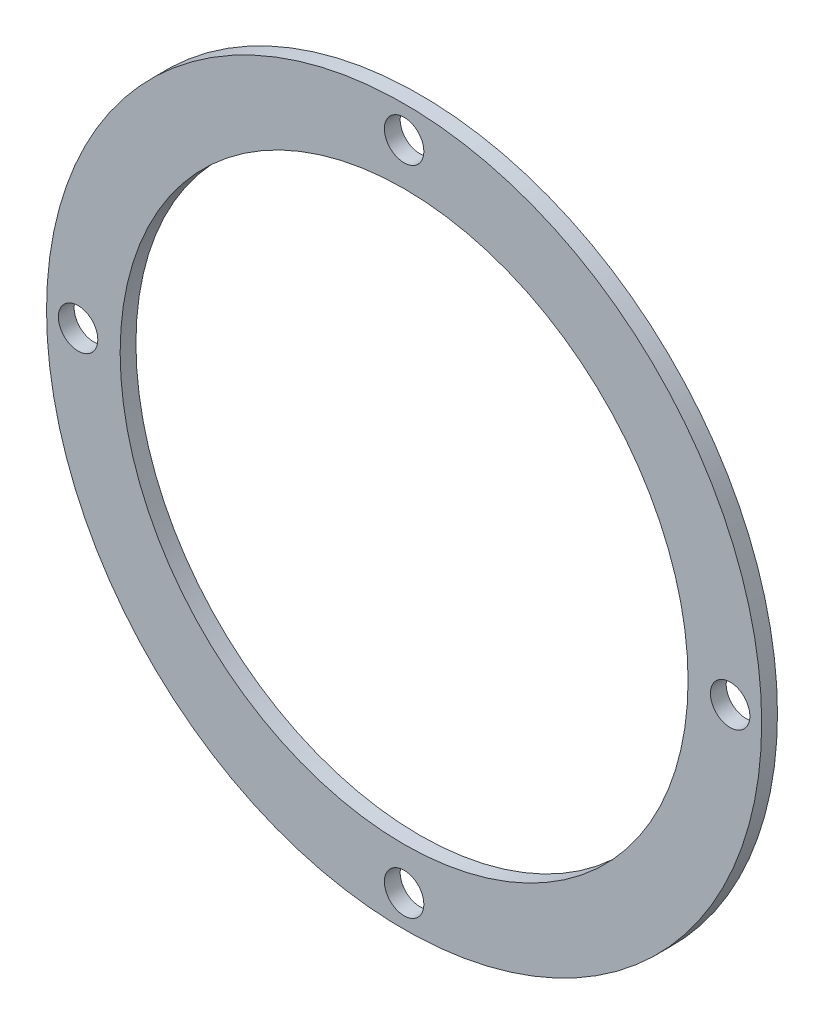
SolidWorks part; units mm, degrees
ref_plane "Plan1" through (0, 0, 0) normal (0, 0, 1) x (1, 0, 0)
ref_plane "Plan2" through (0, 0, 0) normal (0, 1, 0) x (1, 0, 0)
ref_plane "Plan3" through (0, 0, 0) normal (1, 0, 0) x (0, 0, -1)
sketch "Esquisse1" plane through (0, 0, 0) normal (0, 0, 1) x (1, 0, 0)
  line L0 (0, 90) -> (0, -100) construction
  line L1 (-90, 0) -> (80, 0) construction
  circle A0 centre (0, 0) radius 68
  circle A1 centre (0, 0) radius 54
  circle A3 centre (0, 62) radius 3.75
  circle A4 centre (-62, 0) radius 3.75
  circle A5 centre (62, 0) radius 3.75
  circle A6 centre (0, -62) radius 3.75
  dimension "D1" = 136
  dimension "D2" = 108
  dimension "D4" = 7.5
  dimension "D5" = 7.5
  dimension "D6" = 7.5
  dimension "D7" = 7.5
extrude "Base-Extrusion" add sketch "Esquisse1" along normal blind 3
